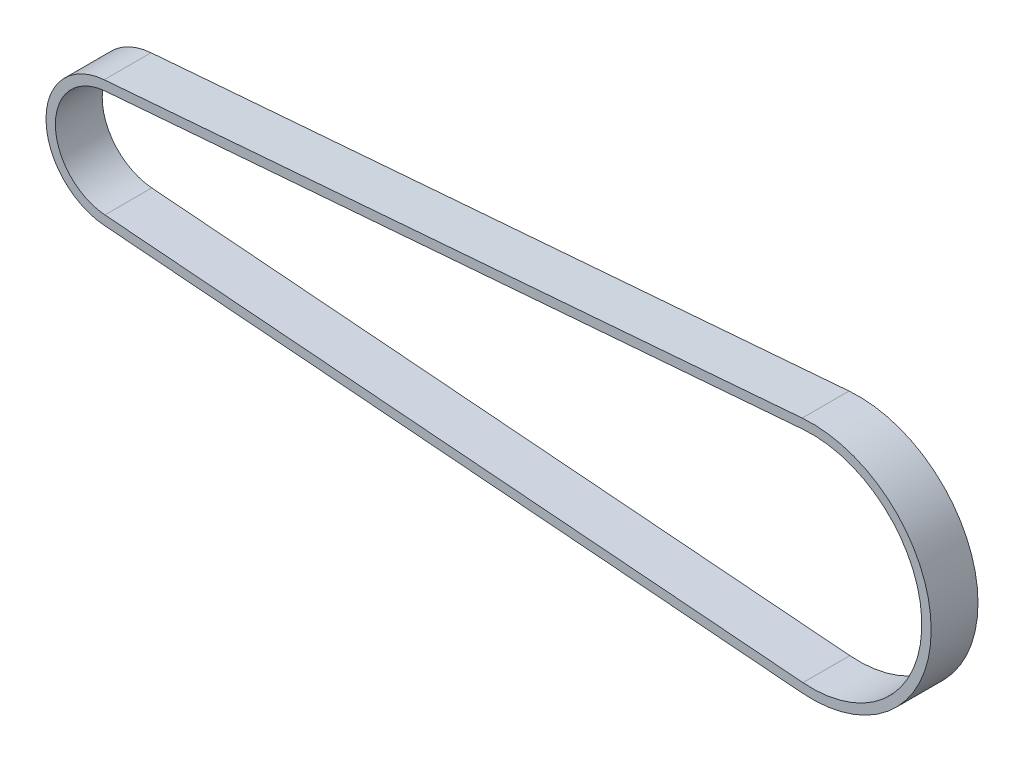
SolidWorks part; units mm, degrees
ref_plane "正面" through (0, 0, 0) normal (0, 0, 1) x (1, 0, 0)
ref_plane "平面" through (0, 0, 0) normal (0, 1, 0) x (1, 0, 0)
ref_plane "右側面" through (0, 0, 0) normal (1, 0, 0) x (0, 0, -1)
sketch "layout" plane through (0, 0, 0) normal (0, 0, 1) x (1, 0, 0)
  line L0 (0, 0) -> (-150, 0) construction
  circle A0 centre (-150, 0) radius 11.5
  circle A1 centre (0, 0) radius 23.5
  dimension "D2" = 23
  dimension "D3" = 47
  dimension "D1" = 150
sketch "ｽｹｯﾁ2" plane through (0, 0, 0) normal (0, 0, 1) x (1, 0, 0)
  line L0 (-150.92, 11.4631) -> (-1.88, 23.4247)
  line L1 (-150.92, -11.4631) -> (-1.88, -23.4247)
  circle A0 centre (-150, 0) radius 11.5 construction
  circle A1 centre (0, 0) radius 23.5 construction
  circle A3 centre (0, 0) radius 23.5
  arc A4 (-1.88, -23.4247) -> (-1.88, 23.4247) centre (0, 0) ccw
  circle A5 centre (-150, 0) radius 11.5
  arc A6 (-150.92, 11.4631) -> (-150.92, -11.4631) centre (-150, 0) ccw
  dimension "D1" = 0
  dimension "D2" = 0
extrude "押し出し-薄板1" add sketch "ｽｹｯﾁ2" along normal blind 10 thin
